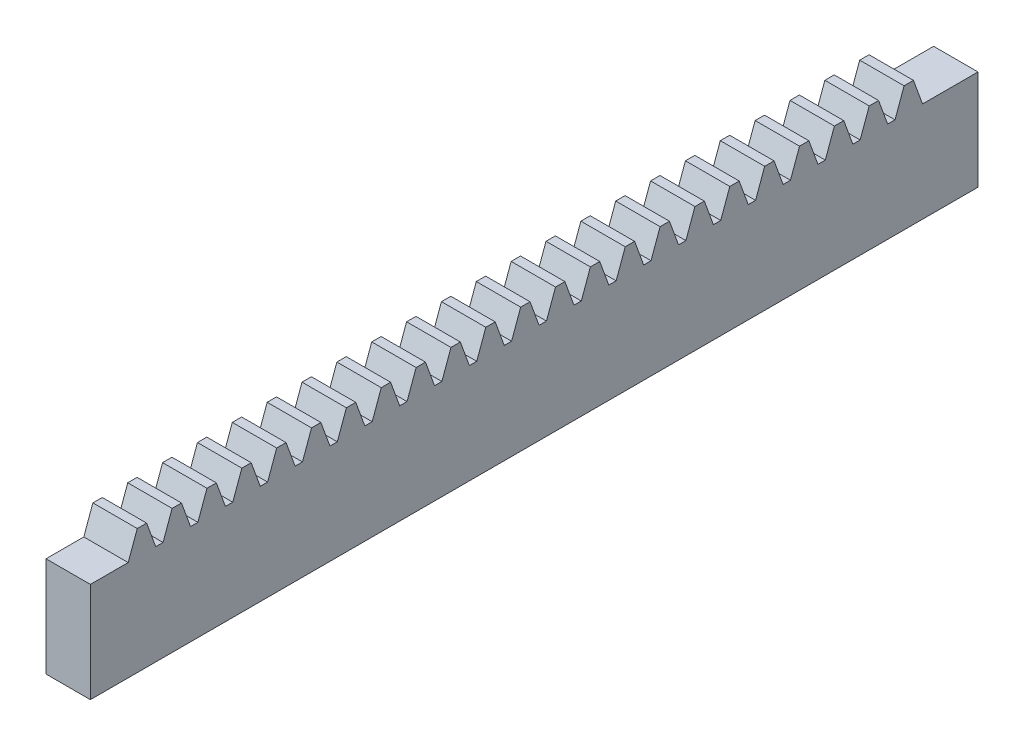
SolidWorks part; units mm, degrees
ref_plane "Front Plane" through (0, 0, 0) normal (1, 0, 0) x (0, 1, 0)
ref_plane "Top Plane" through (0, 0, 0) normal (0, 0, 1) x (0, 1, 0)
ref_plane "Right Plane" through (0, 0, 0) normal (0, 1, 0) x (-1, 0, 0)
sketch "Sketch1" plane through (0, 0, 0) normal (1, 0, 0) x (0, 1, 0)
  line L1 (-9, -80) -> (9, -80)
  line L2 (-9, -80) -> (-9, 80)
  line L3 (-9, 80) -> (9, 80)
  line L4 (9, -80) -> (9, 80)
  line L5 (-9, -80) -> (9, 80) construction
  line L6 (-9, 80) -> (9, -80) construction
  point P0 (0, 0)
  dimension "D1" = 160
  dimension "D2" = 18
extrude "Boss-Extrude1" add sketch "Sketch1" along normal blind 8
sketch "Sketch2" plane through (0, 0, 0) normal (1, 0, 0) x (0, 1, 0)
  line L0 (9, -70) -> (9, -65.04)
  line L1 (9, -80) -> (9, 80) construction
  line L5 (-9, -80) -> (9, -80) construction
  line L6 (9, -67.52) -> (13.5, -67.52) construction
  line L7 (13.5, -67.52) -> (13.5, -68.365)
  line L8 (13.5, -67.52) -> (13.5, -66.675)
  line L9 (9, -65.04) -> (13.5, -66.675)
  line L10 (9, -70) -> (13.5, -68.365)
  dimension "D1" = 10
  dimension "D2" = 4.96
  dimension "D3" = 0.845
  dimension "D4" = 0.845
  dimension "D5" = 4.5
extrude "Boss-Extrude2" add sketch "Sketch2" along normal blind 8
pattern_linear "LPattern1" count 23 spacing 6.283 along (0, 0, 1) of "Boss-Extrude2"
